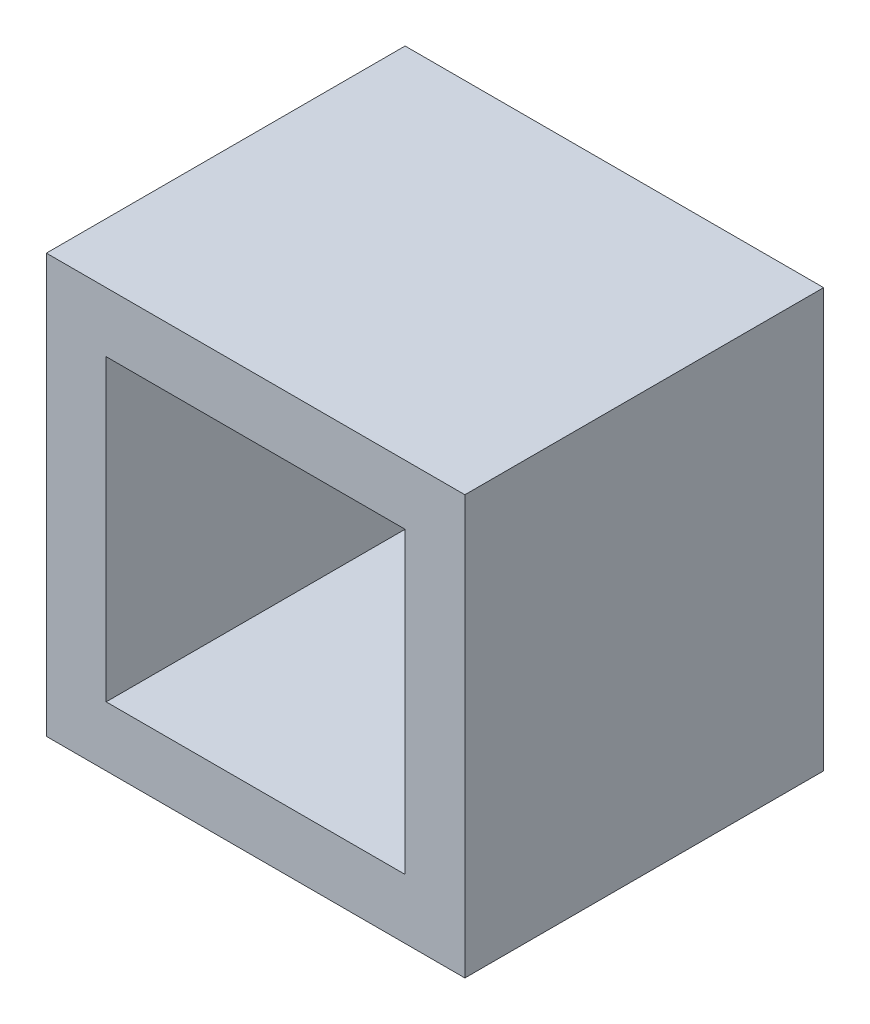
SolidWorks part; units mm, degrees
ref_plane "Płaszczyzna przednia" through (0, 0, 0) normal (0, 0, 1) x (1, 0, 0)
ref_plane "Płaszczyzna górna" through (0, 0, 0) normal (0, 1, 0) x (1, 0, 0)
ref_plane "Płaszczyzna prawa" through (0, 0, 0) normal (1, 0, 0) x (0, 0, -1)
sketch "Szkic1" plane through (0, 0, 0) normal (0, 0, 1) x (1, 0, 0)
  line L1 (25, -25) -> (-25, -25)
  line L2 (25, -25) -> (25, 25)
  line L3 (25, 25) -> (-25, 25)
  line L4 (-25, -25) -> (-25, 25)
  line L5 (25, -25) -> (-25, 25) construction
  line L6 (25, 25) -> (-25, -25) construction
  line L7 (35, -35) -> (-35, -35)
  line L8 (35, -35) -> (35, 35)
  line L9 (35, 35) -> (-35, 35)
  line L10 (-35, -35) -> (-35, 35)
  line L11 (35, -35) -> (-35, 35) construction
  line L12 (35, 35) -> (-35, -35) construction
  point P0 (0, 0)
  point P6 (0, 0)
  dimension "D1" = 70
  dimension "D2" = 50
extrude "Dodanie-wyciągnięcie1" add sketch "Szkic1" along normal blind 60
